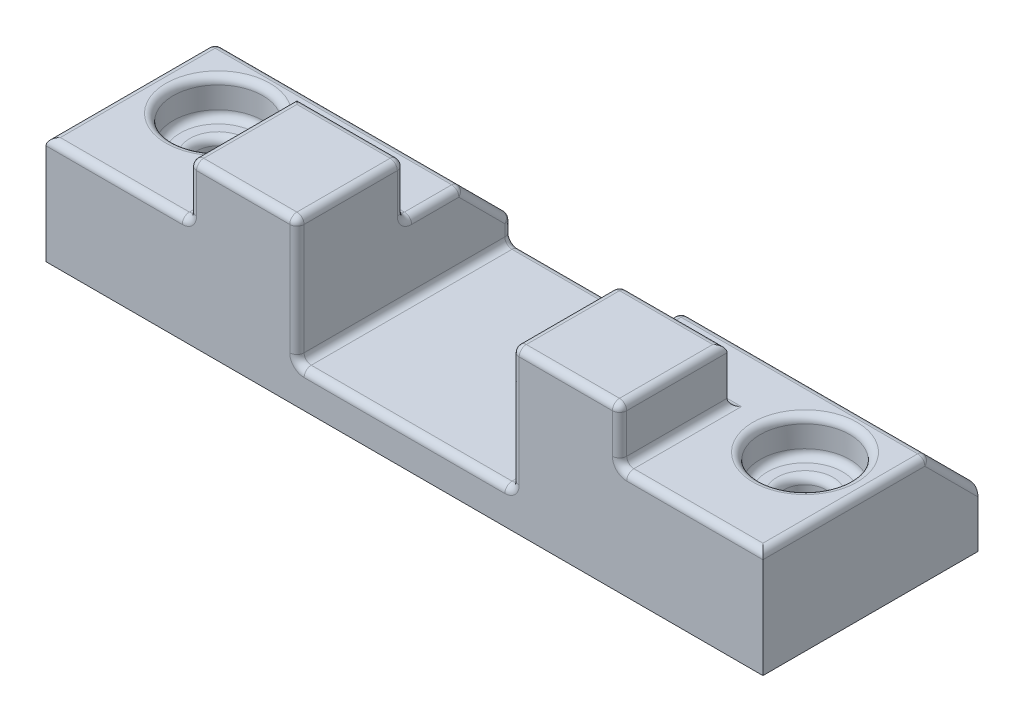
SolidWorks part; units mm, degrees
ref_plane "Front" through (0, 0, 0) normal (0, 0, 1) x (1, 0, 0)
ref_plane "Top" through (0, 0, 0) normal (0, 1, 0) x (1, 0, 0)
ref_plane "Right" through (0, 0, 0) normal (1, 0, 0) x (0, 0, -1)
sketch "Sketch1" plane through (0, 0, 0) normal (0, 0, 1) x (1, 0, 0)
  line L1 (0, 0) -> (200, 0)
  line L2 (0, 0) -> (0, -30)
  line L3 (0, -30) -> (200, -30)
  line L4 (200, 0) -> (200, -30)
  dimension "D1" = 200
  dimension "D2" = 30
extrude "Extrude1" add sketch "Sketch1" along normal blind 60
sketch "Sketch2" plane through (0, 0, 0) normal (0, 1, 0) x (-1, 0, 0)
  line L0 (-70, 60) -> (-130, 60)
  line L5 (-130, 60) -> (-130, 0)
  line L6 (-70, 60) -> (-70, 0)
  line L7 (-70, 0) -> (-130, 0)
  line L8 (-100, 79.8136) -> (-100, -28.4638) construction
  line L9 (-200, 60) -> (-200, 0) construction
  dimension "D1" = 100
  dimension "D2" = 30
  dimension "D3" = 30
extrude "Cut-Extrude1" cut sketch "Sketch2" against normal blind 20
sketch "Sketch3" plane through (0, 0, 0) normal (0, 1, 0) x (-1, 0, 0)
  line L1 (-130, 60) -> (-160, 60)
  line L2 (-130, 60) -> (-130, 30)
  line L3 (-130, 30) -> (-160, 30)
  line L4 (-160, 60) -> (-160, 30)
  line L5 (-70, 60) -> (-40, 60)
  line L6 (-70, 60) -> (-70, 30)
  line L7 (-70, 30) -> (-40, 30)
  line L8 (-40, 60) -> (-40, 30)
  dimension "D1" = 30
  dimension "D2" = 30
  dimension "D3" = 30
  dimension "D4" = 30
extrude "Extrude2" add sketch "Sketch3" along normal blind 15
sketch "Sketch5" plane through (0, 0, 0) normal (0, 1, 0) x (-1, 0, 0)
  line L0 (-100, 88.4814) -> (-100, -32.7276) construction
  line L1 (-200, 60) -> (-200, 0) construction
  line L2 (-100, 97.7458) -> (-100, -53.5724) construction
  circle A0 centre (-181.8792, 30.1404) radius 12.5
  circle A1 centre (-18.1208, 30.1404) radius 12.5
  dimension "D2" = 25
  dimension "D1" = 100
extrude "Cut-Extrude2" cut sketch "Sketch5" against normal blind 10
sketch "Sketch6" plane through (0, -10, 0) normal (0, 1, 0) x (-1, 0, 0)
  line L0 (-100, 68.7946) -> (-100, -49.7122) construction
  line L2 (-100, 85.3933) -> (-100, -65.9249) construction
  circle A0 centre (-181.8792, 30.1404) radius 5.8341
  circle A1 centre (-18.1208, 30.1404) radius 5.8341
  circle A2 centre (-181.8792, 30.1404) radius 12.5 construction
  circle A3 centre (-18.1208, 30.1404) radius 12.5 construction
extrude "Cut-Extrude3" cut sketch "Sketch6" against normal through all
chamfer "Chamfer1" distance 14 angle 45 2 edges at (35, 0, 0) (165, 0, 0)
fillet "Fillet2" radius 2 6 edges at (181.8792, 0, 42.6404) (18.1208, -10, 24.3063) (18.1208, -10, 17.6404) (18.1208, 0, 17.6404) (181.8792, -10, 42.6404) (181.8792, -10, 35.9745)
fillet "Fillet3" radius 2 38 edges at (70, -2.5, 60) (130, -2.5, 60) (70, -17, 0) (130, -17, 0) (70, 7.5, 30) (40, 7.5, 60) (160, 7.5, 60) (130, 7.5, 30) (130, -7, 7) (165, -14, 0) (200, -7, 7) (100, -20, 60) (70, -20, 30) (100, -20, 0) (130, -20, 30) (0, -7, 7) (35, -14, 0) (70, -7, 7) (55, 0, 30) (40, 0, 45) (20, 0, 60) (0, 0, 37) (35, 0, 14) (70, 0, 22) (55, 15, 60) (40, 15, 45) (55, 15, 30) (70, 15, 45) (145, 15, 30) (160, 15, 45) (145, 15, 60) (130, 15, 45) (180, 0, 60) (160, 0, 45) (145, 0, 30) (130, 0, 22) (165, 0, 14) (200, 0, 37)
fillet "Fillet4" radius 2 2 edges at (18.1208, -30, 24.3063) (181.8792, -30, 35.9745)
